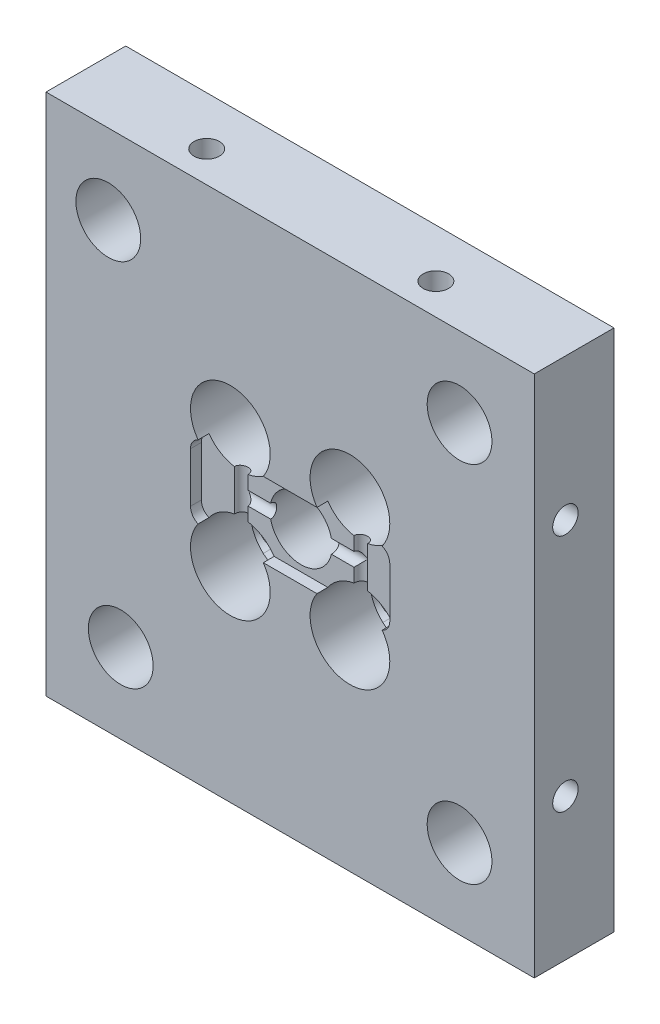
SolidWorks part; units mm, degrees
ref_plane "Plan de face" through (0, 0, 0) normal (0, 0, 1) x (1, 0, 0)
ref_plane "Plan de dessus" through (0, 0, 0) normal (0, 1, 0) x (1, 0, 0)
ref_plane "Plan de droite" through (0, 0, 0) normal (1, 0, 0) x (0, 0, -1)
sketch "Esquisse1" plane through (0, 0, 0) normal (0, 0, 1) x (1, 0, 0)
  line L1 (0, 0) -> (196, 0)
  line L2 (0, 0) -> (0, 210)
  line L3 (0, 210) -> (196, 210)
  line L4 (196, 0) -> (196, 210)
  dimension "D1" = 210
  dimension "D2" = 196
extrude "Extrusion1" add sketch "Esquisse1" along normal blind 32
sketch "Esquisse3" plane through (0, 0, 0) normal (0, 0, -1) x (-1, 0, 0)
  line L0 (-98, 210) -> (-98, 0) construction
  line L1 (-196, 210) -> (0, 210) construction
  line L2 (0, 0) -> (-196, 0) construction
  line L3 (-196, 105) -> (0, 105) construction
  line L4 (-196, 0) -> (-196, 210) construction
  line L5 (0, 210) -> (0, 0) construction
  line L6 (-214.75, 178) -> (45.0645, 178) construction
  line L7 (-218.7232, 32) -> (22.112, 32) construction
  line L8 (-166, 220.8332) -> (-166, -13.5838) construction
  line L9 (-25, 217.4713) -> (-25, -13.5838) construction
  line L10 (-30, 58.141) -> (-30, 3.3602) construction
  circle A0 centre (-25, 178) radius 13
  circle A1 centre (-166, 178) radius 13
  circle A2 centre (-166, 32) radius 13
  circle A3 centre (-30, 32) radius 13
  circle A8 centre (-98, 105) radius 12.5
  dimension "D6" = 25
  dimension "D7" = 26
  dimension "D9" = 26
  dimension "D10" = 26
  dimension "D8" = 26
  dimension "D1" = 73
  dimension "D2" = 73
  dimension "D3" = 68
  dimension "D4" = 73
  dimension "D5" = 68
extrude "Enlèv. mat.-Extru.1" cut sketch "Esquisse3" against normal through all
hole_wizard "Trou taraudé M8x1.251" positions "Esquisse11" profile "Esquisse10" tap size "M8x1.25" standard "ISO"
sketch "Esquisse11" plane through (0, 0, 0) normal (0, 0, -1) x (-1, 0, 0)
  line L0 (-196, 105) -> (0, 105) construction
  line L1 (-196, 0) -> (-196, 210) construction
  line L2 (0, 210) -> (0, 0) construction
  line L3 (-98, 210) -> (-98, 0) construction
  line L4 (-196, 210) -> (0, 210) construction
  line L5 (0, 0) -> (-196, 0) construction
  point P0 (-18, 75)
  point P1 (-18, 135)
  point P2 (-178, 135)
  point P3 (-178, 75)
  dimension "D1" = 30
  dimension "D2" = 30
  dimension "D3" = 30
  dimension "D4" = 30
  dimension "D5" = 80
  dimension "D6" = 80
  dimension "D7" = 80
  dimension "D8" = 80
sketch "Esquisse10" plane through (18, 75, 0) normal (1, 0, 0) x (0, 1, 0)
  line L0 (0, 0) -> (0, 20.2929)
  line L1 (0, 20.2929) -> (3.4, 18.25)
  line L2 (3.4, 18.25) -> (3.4, 0)
  line L5 (3.4, 0) -> (0, 0)
  line L10 (0, 20.2929) -> (-3.4, 18.25) construction
  line L11 (0, -6.35) -> (0, 107.95) construction
  dimension "Diamètre du trou pour taraudage" = 6.8
  dimension "Profondeur du trou pour taraudage" = 18.25
  dimension "Angle de pointe" = 118
sketch "Esquisse12" plane through (0, 0, 32) normal (0, 0, 1) x (1, 0, 0)
  line L0 (98, 210) -> (98, 0) construction
  line L1 (63, 120) -> (133, 120)
  line L2 (58, 115) -> (58, 95)
  line L3 (63, 90) -> (133, 90)
  line L4 (138, 115) -> (138, 95)
  line L5 (196, 210) -> (0, 210) construction
  line L6 (0, 0) -> (196, 0) construction
  line L7 (0, 105) -> (196, 105) construction
  line L8 (0, 210) -> (0, 0) construction
  line L9 (196, 0) -> (196, 210) construction
  arc A0 (63, 120) -> (58, 115) centre (63, 115) ccw
  arc A1 (133, 120) -> (138, 115) centre (133, 115) cw
  arc A2 (133, 90) -> (138, 95) centre (133, 95) ccw
  arc A3 (58, 95) -> (63, 90) centre (63, 95) ccw
  point P18 (58, 120)
  point P21 (138, 120)
  point P24 (138, 90)
  dimension "D5" = 5
  dimension "D1" = 30
  dimension "D2" = 80
  dimension "D3" = 15
  dimension "D4" = 40
extrude "Enlèv. mat.-Extru.6" cut sketch "Esquisse12" against normal blind 4.36
sketch "Esquisse13" plane through (0, 0, 32) normal (0, 0, 1) x (1, 0, 0)
  line L0 (40.9078, 129) -> (163.1596, 129) construction
  line L1 (40.9078, 81) -> (163.1596, 81) construction
  line L2 (122, 152.1631) -> (122, 49.4592) construction
  line L3 (74, 144.406) -> (74, 55.9752) construction
  line L4 (98, 210) -> (98, 0) construction
  line L5 (196, 210) -> (0, 210) construction
  line L6 (0, 0) -> (196, 0) construction
  line L7 (0, 105) -> (196, 105) construction
  line L8 (0, 210) -> (0, 0) construction
  line L9 (196, 0) -> (196, 210) construction
  circle A0 centre (122, 129) radius 16
  circle A1 centre (74, 129) radius 16
  circle A2 centre (74, 81) radius 16
  circle A3 centre (122, 81) radius 16
  dimension "D5" = 32
  dimension "D6" = 32
  dimension "D7" = 32
  dimension "D8" = 32
  dimension "D1" = 24
  dimension "D2" = 24
  dimension "D3" = 24
  dimension "D4" = 24
extrude "Enlèv. mat.-Extru.7" cut sketch "Esquisse13" against normal through all
sketch "Esquisse15" plane through (0, 0, 0) normal (0, -1, 0) x (1, 0, 0)
  line L0 (0, 32) -> (196, 32) construction
  line L1 (98, 0) -> (98, 86.4322) construction
  line L2 (0, 0) -> (196, 0) construction
  circle A0 centre (74, 19.5) radius 11
  circle A1 centre (122, 19.5) radius 11
  dimension "D1" = 22
  dimension "D2" = 22
  dimension "D3" = 12.5
  dimension "D4" = 12.5
  dimension "D5" = 24
  dimension "D6" = 24
extrude "Enlèv. mat.-Extru.9" cut sketch "Esquisse15" against normal blind 18
hole_wizard "Diamètre du perçage M8.0 (8.000000)1" positions "Esquisse17" profile "Esquisse16" hole size "M8.0" standard "ISO"
sketch "Esquisse17" plane through (0, 0, 0) normal (0, -1, 0) x (1, 0, 0)
  circle A0 centre (122, 19.5) radius 11 construction
  circle A1 centre (74, 19.5) radius 11 construction
  point P0 (122, 19.5)
  point P1 (74, 19.5)
sketch "Esquisse16" plane through (122, 0, 19.5) normal (1, 0, 0) x (0, 0, -1)
  line L0 (0, 0) -> (0, 61)
  line L1 (0, 61) -> (4, 57)
  line L2 (4, 57) -> (4, 0)
  line L5 (4, 0) -> (0, 0)
  line L10 (0, 61) -> (-4, 57) construction
  line L11 (0, -6.35) -> (0, 107.95) construction
  dimension "Diamètre du perçage" = 8
  dimension "Profondeur du perçage" = 57
  dimension "Angle de pointe" = 90
hole_wizard "Diamètre du perçage M8.0 (8.000000)2" positions "Esquisse19" profile "Esquisse18" hole size "M8.0" standard "ISO"
sketch "Esquisse19" plane through (0, 210, 0) normal (0, 1, 0) x (-1, 0, 0)
  line L0 (-196, 32) -> (0, 32) construction
  line L1 (-98, 32) -> (-98, -63.4709) construction
  point P0 (-144, 19.5)
  point P1 (-52, 19.5)
  dimension "D1" = 12.5
  dimension "D2" = 12.5
  dimension "D3" = 46
  dimension "D4" = 46
sketch "Esquisse18" plane through (144, 210, 19.5) normal (1, 0, 0) x (0, 0, 1)
  line L0 (0, 0) -> (0, 157)
  line L1 (0, 157) -> (4, 153)
  line L2 (4, 153) -> (4, 0)
  line L5 (4, 0) -> (0, 0)
  line L10 (0, 157) -> (-4, 153) construction
  line L11 (0, -6.35) -> (0, 107.95) construction
  dimension "Diamètre du perçage" = 8
  dimension "Profondeur du perçage" = 153
  dimension "Angle de pointe" = 90
hole_wizard "Diamètre du perçage M8.0 (8.000000)3" positions "Esquisse21" profile "Esquisse20" hole size "M8.0" standard "ISO"
sketch "Esquisse21" plane through (196, 0, 0) normal (1, 0, 0) x (0, 0, -1)
  line L1 (-32, 105) -> (51.9011, 105) construction
  line L2 (-32, 0) -> (-32, 210) construction
  point P0 (-19.5, 57)
  dimension "D1" = 12.5
  dimension "D2" = 48
sketch "Esquisse20" plane through (196, 57, 19.5) normal (0, 1, 0) x (0, 0, -1)
  line L0 (0, 0) -> (0, 82)
  line L1 (0, 82) -> (4, 78)
  line L2 (4, 78) -> (4, 0)
  line L5 (4, 0) -> (0, 0)
  line L10 (0, 82) -> (-4, 78) construction
  line L11 (0, -6.35) -> (0, 107.95) construction
  dimension "Diamètre du perçage" = 8
  dimension "Profondeur du perçage" = 78
  dimension "Angle de pointe" = 90
hole_wizard "Diamètre du perçage M8.0 (8.000000)4" positions "Esquisse23" profile "Esquisse22" hole size "M8.0" standard "ISO"
sketch "Esquisse23" plane through (196, 0, 0) normal (1, 0, 0) x (0, 0, -1)
  line L0 (-32, 0) -> (-32, 210) construction
  line L1 (-32, 105) -> (59.2927, 105) construction
  point P0 (-19.5, 153)
  dimension "D1" = 12.5
  dimension "D2" = 48
sketch "Esquisse22" plane through (196, 153, 19.5) normal (0, 1, 0) x (0, 0, -1)
  line L0 (0, 0) -> (0, 148)
  line L1 (0, 148) -> (4, 144)
  line L2 (4, 144) -> (4, 0)
  line L5 (4, 0) -> (0, 0)
  line L10 (0, 148) -> (-4, 144) construction
  line L11 (0, -6.35) -> (0, 107.95) construction
  dimension "Diamètre du perçage" = 8
  dimension "Profondeur du perçage" = 144
  dimension "Angle de pointe" = 90
hole_wizard "Diamètre du perçage M8.0 (8.000000)5" positions "Esquisse25" profile "Esquisse24" hole size "M8.0" standard "ISO"
sketch "Esquisse25" plane through (0, 0, 0) normal (-1, 0, 0) x (0, 0, 1)
  line L0 (32, 210) -> (32, 0) construction
  line L1 (32, 105) -> (-55.2279, 105) construction
  point P0 (19.5, 57)
  dimension "D1" = 12.5
  dimension "D2" = 48
sketch "Esquisse24" plane through (0, 57, 19.5) normal (0, 1, 0) x (0, 0, 1)
  line L0 (0, 0) -> (0, 82)
  line L1 (0, 82) -> (4, 78)
  line L2 (4, 78) -> (4, 0)
  line L5 (4, 0) -> (0, 0)
  line L10 (0, 82) -> (-4, 78) construction
  line L11 (0, -6.35) -> (0, 107.95) construction
  dimension "Diamètre du perçage" = 8
  dimension "Profondeur du perçage" = 78
  dimension "Angle de pointe" = 90
hole_wizard "Trou taraudé M12x1.751" positions "Esquisse27" profile "Esquisse26" tap size "M12x1.75" standard "ISO"
sketch "Esquisse27" plane through (196, 0, 0) normal (1, 0, 0) x (0, 0, -1)
  circle A0 centre (-19.5, 57) radius 4 construction
  circle A1 centre (-19.5, 153) radius 4 construction
  point P0 (-19.5, 153)
  point P1 (-19.5, 57)
sketch "Esquisse26" plane through (196, 153, 19.5) normal (0, 1, 0) x (0, 0, -1)
  line L0 (0, 0) -> (0, 10)
  line L1 (0, 10) -> (5.1, 10)
  line L2 (5.1, 10) -> (5.1, 0)
  line L5 (5.1, 0) -> (0, 0)
  line L10 (0, 10) -> (-5.1, 10) construction
  line L11 (0, -6.35) -> (0, 107.95) construction
  dimension "Diamètre du trou pour taraudage" = 10.2
  dimension "Profondeur du trou pour taraudage" = 10
  dimension "Angle de pointe" = 180
hole_wizard "Trou taraudé M12x1.752" positions "Esquisse29" profile "Esquisse28" tap size "M12x1.75" standard "ISO"
sketch "Esquisse29" plane through (0, 210, 0) normal (0, 1, 0) x (-1, 0, 0)
  circle A0 centre (-144, 19.5) radius 4 construction
  circle A1 centre (-52, 19.5) radius 4 construction
  point P0 (-52, 19.5)
  point P1 (-144, 19.5)
sketch "Esquisse28" plane through (52, 210, 19.5) normal (1, 0, 0) x (0, 0, 1)
  line L0 (0, 0) -> (0, 10)
  line L1 (0, 10) -> (5.1, 10)
  line L2 (5.1, 10) -> (5.1, 0)
  line L5 (5.1, 0) -> (0, 0)
  line L10 (0, 10) -> (-5.1, 10) construction
  line L11 (0, -6.35) -> (0, 107.95) construction
  dimension "Diamètre du trou pour taraudage" = 10.2
  dimension "Profondeur du trou pour taraudage" = 10
  dimension "Angle de pointe" = 180
hole_wizard "Trou taraudé M12x1.753" positions "Esquisse31" profile "Esquisse30" tap size "M12x1.75" standard "ISO"
sketch "Esquisse31" plane through (0, 0, 0) normal (-1, 0, 0) x (0, 0, 1)
  circle A0 centre (19.5, 57) radius 4 construction
  point P0 (19.5, 57)
sketch "Esquisse30" plane through (0, 57, 19.5) normal (0, 1, 0) x (0, 0, 1)
  line L0 (0, 0) -> (0, 10)
  line L1 (0, 10) -> (5.1, 10)
  line L2 (5.1, 10) -> (5.1, 0)
  line L5 (5.1, 0) -> (0, 0)
  line L10 (0, 10) -> (-5.1, 10) construction
  line L11 (0, -6.35) -> (0, 107.95) construction
  dimension "Diamètre du trou pour taraudage" = 10.2
  dimension "Profondeur du trou pour taraudage" = 10
  dimension "Angle de pointe" = 180
hole_wizard "Trou taraudé M12x1.754" positions "Esquisse33" profile "Esquisse32" tap size "M12x1.75" standard "ISO"
sketch "Esquisse33" plane through (0, 18, 0) normal (0, -1, 0) x (1, 0, 0)
  circle A0 centre (74, 19.5) radius 4 construction
  circle A1 centre (122, 19.5) radius 4 construction
  point P0 (74, 19.5)
  point P1 (122, 19.5)
sketch "Esquisse32" plane through (74, 18, 19.5) normal (1, 0, 0) x (0, 0, -1)
  line L0 (0, 0) -> (0, 10)
  line L1 (0, 10) -> (5.1, 10)
  line L2 (5.1, 10) -> (5.1, 0)
  line L5 (5.1, 0) -> (0, 0)
  line L10 (0, 10) -> (-5.1, 10) construction
  line L11 (0, -6.35) -> (0, 107.95) construction
  dimension "Diamètre du trou pour taraudage" = 10.2
  dimension "Profondeur du trou pour taraudage" = 10
  dimension "Angle de pointe" = 180
sketch "Esquisse34" plane through (0, 0, 0) normal (0, 0, -1) x (-1, 0, 0)
  line L0 (-107, 65) -> (-137, 65) construction
  line L2 (-137, 97) -> (-107, 97) construction
  line L3 (-101, 91) -> (-101, 71) construction
  line L4 (-143, 71) -> (-143, 91) construction
  line L5 (-107, 65) -> (-137, 65)
  line L6 (-98, 0) -> (-98, 210) construction
  line L7 (-137, 97) -> (-107, 97)
  line L8 (-101, 91) -> (-101, 71)
  line L9 (-143, 71) -> (-143, 91)
  line L10 (0, 0) -> (-196, 0) construction
  line L11 (-196, 210) -> (0, 210) construction
  line L12 (-53, 71) -> (-53, 91)
  line L13 (-95, 91) -> (-95, 71)
  line L14 (-59, 97) -> (-89, 97)
  line L15 (-89, 65) -> (-59, 65)
  line L16 (-196, 105) -> (0, 105) construction
  line L17 (-196, 0) -> (-196, 210) construction
  line L18 (0, 210) -> (0, 0) construction
  line L19 (-89, 145) -> (-59, 145)
  line L20 (-59, 113) -> (-89, 113)
  line L21 (-95, 119) -> (-95, 139)
  line L22 (-53, 139) -> (-53, 119)
  line L23 (-143, 139) -> (-143, 119)
  line L24 (-101, 119) -> (-101, 139)
  line L25 (-137, 113) -> (-107, 113)
  line L26 (-107, 145) -> (-137, 145)
  arc A0 (-137, 97) -> (-143, 91) centre (-137, 91) ccw construction
  arc A1 (-101, 91) -> (-107, 97) centre (-107, 91) ccw construction
  arc A2 (-107, 65) -> (-101, 71) centre (-107, 71) ccw construction
  arc A3 (-143, 71) -> (-137, 65) centre (-137, 71) ccw construction
  arc A4 (-137, 97) -> (-143, 91) centre (-137, 91) ccw
  arc A5 (-101, 91) -> (-107, 97) centre (-107, 91) ccw
  arc A6 (-107, 65) -> (-101, 71) centre (-107, 71) ccw
  arc A7 (-143, 71) -> (-137, 65) centre (-137, 71) ccw
  arc A8 (-53, 71) -> (-59, 65) centre (-59, 71) cw
  arc A9 (-89, 65) -> (-95, 71) centre (-89, 71) cw
  arc A10 (-95, 91) -> (-89, 97) centre (-89, 91) cw
  arc A11 (-59, 97) -> (-53, 91) centre (-59, 91) cw
  arc A12 (-59, 113) -> (-53, 119) centre (-59, 119) ccw
  arc A13 (-95, 119) -> (-89, 113) centre (-89, 119) ccw
  arc A14 (-89, 145) -> (-95, 139) centre (-89, 139) ccw
  arc A15 (-53, 139) -> (-59, 145) centre (-59, 139) ccw
  arc A16 (-143, 139) -> (-137, 145) centre (-137, 139) cw
  arc A17 (-107, 145) -> (-101, 139) centre (-107, 139) cw
  arc A18 (-101, 119) -> (-107, 113) centre (-107, 119) cw
  arc A19 (-137, 113) -> (-143, 119) centre (-137, 119) cw
extrude "Enlèv. mat.-Extru.10" cut sketch "Esquisse34" against normal blind 8
sketch "Esquisse35" plane through (0, 0, 27.64) normal (0, 0, 1) x (1, 0, 0)
  line L0 (45.6223, 105) -> (160.4052, 105) construction
  line L1 (122, 81) -> (122, 129) construction
  line L2 (73.99, 102.25) -> (122.01, 102.25)
  line L3 (71.25, 104.99) -> (71.25, 105)
  line L4 (71.25, 105) -> (124.75, 105)
  line L5 (124.75, 104.99) -> (124.75, 105)
  line L6 (74, 129) -> (74, 81) construction
  arc A0 (73.99, 102.25) -> (71.25, 104.99) centre (73.99, 104.99) cw
  arc A1 (122.01, 102.25) -> (124.75, 104.99) centre (122.01, 104.99) ccw
  point P15 (124.75, 102.25)
  dimension "D4" = 2.74
  dimension "D1" = 2.75
  dimension "D2" = 2.75
  dimension "D3" = 2.75
revolve "Enlèvement de matière-Révolution4" cut sketch "Esquisse35" angle 360 about L0
sketch "Esquisse36" plane through (0, 0, 27.64) normal (0, 0, 1) x (1, 0, 0)
  line L0 (73.99, 116.9988) -> (73.99, 90.0652) construction
  line L1 (73.99, 107.75) -> (73.99, 102.25) construction
  line L2 (73.99, 115.0514) -> (76.74, 115.0514)
  line L3 (73.99, 115.0514) -> (73.99, 95.9766)
  line L4 (73.99, 95.9766) -> (76.74, 95.9766)
  line L5 (76.74, 115.0514) -> (76.74, 95.9766)
  dimension "D1" = 2.75
revolve "Enlèvement de matière-Révolution5" cut sketch "Esquisse36" angle 360 about L0
ref_plane "Plan1" through (98, 0, 0) normal (1, 0, 0) x (0, 0, -1)
mirror "Symétrie1" about plane through (98, 0, 0) normal (1, 0, 0) of "Enlèvement de matière-Révolution5"
